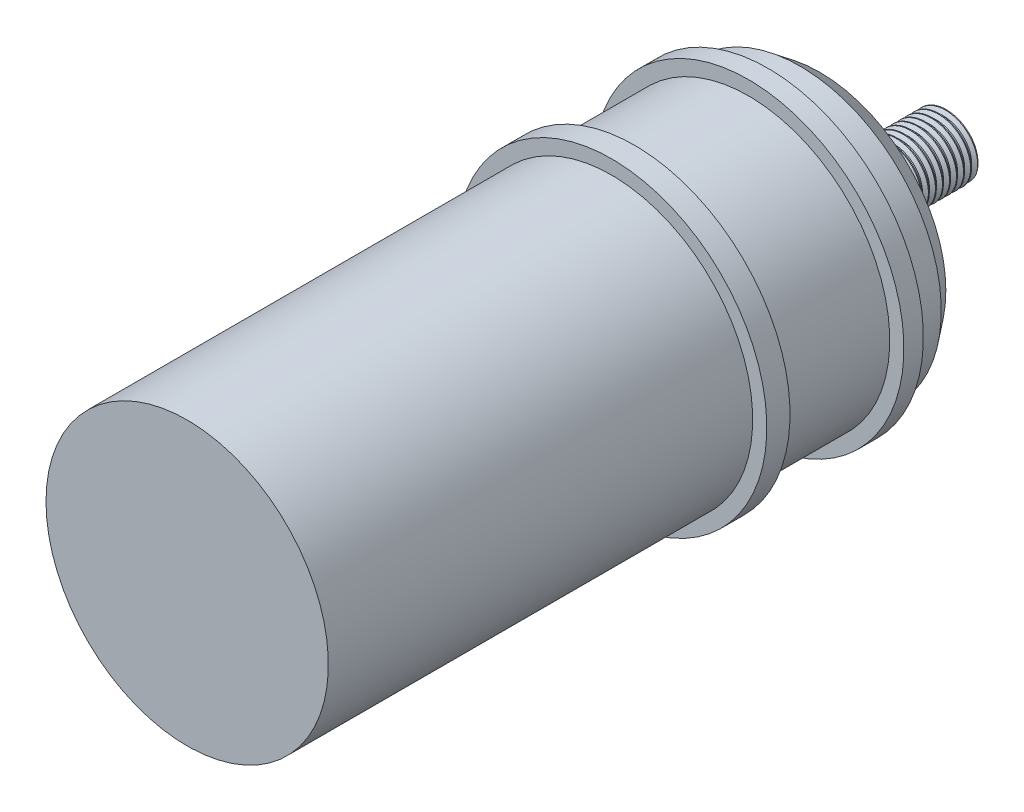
SolidWorks part; units mm, degrees
ref_plane "Front Plane" through (0, 0, 0) normal (0, 0, 1) x (1, 0, 0)
ref_plane "Top Plane" through (0, 0, 0) normal (0, 1, 0) x (1, 0, 0)
ref_plane "Right Plane" through (0, 0, 0) normal (1, 0, 0) x (0, 0, -1)
sketch "Sketch1" plane through (0, 0, 0) normal (1, 0, 0) x (0, 0, -1)
  line L0 (-95.3804, 0) -> (-95.3804, 21.2564)
  line L1 (-95.3804, 21.2564) -> (-31.4943, 21.2564)
  line L2 (-31.4943, 21.2564) -> (-31.4943, 23.3807)
  line L3 (-31.4943, 23.3807) -> (-28.0015, 23.3807)
  line L4 (-28.0015, 23.3807) -> (-28.0015, 21.2564)
  line L5 (-28.0015, 21.2564) -> (-10.8586, 21.2564)
  line L6 (-10.8586, 21.2564) -> (-10.8586, 23.3807)
  line L7 (-10.8586, 23.3807) -> (-7.9217, 23.3807)
  line L8 (-7.9217, 23.3807) -> (-7.9217, 21.2564)
  line L9 (-7.9217, 21.2564) -> (-3.1046, 21.2564)
  line L10 (-0.1304, 18.9726) -> (-0.1304, 4.7625)
  line L11 (-0.1304, 4.7625) -> (18.9196, 4.7625)
  line L12 (18.9196, 4.7625) -> (18.9196, 1.778)
  line L13 (-0.1304, 0) -> (-95.3804, 0)
  line L14 (18.9196, 1.778) -> (-0.1304, 1.778)
  line L15 (-0.1304, 1.778) -> (-0.1304, 0)
  line L16 (18.9196, 0) -> (-0.1304, 0) construction
  line L17 (18.9196, 1.778) -> (18.9196, 0) construction
  line L18 (-3.1046, 21.2564) -> (-0.1304, 18.9726)
  dimension "D1" = 114.3
  dimension "D2" = 4.7625
  dimension "D3" = 19.05
  dimension "D4" = 1.778
revolve "Revolve1" add sketch "Sketch1" angle 360 about L13
thread "Thread1" pitch 1.0583 start angle 0, offset 1, length 0, pitch 1.0583, diameter 9.525
ref_plane "Plane1" through (4.7625, 0, -19.9196) normal (0, -1, 0) x (1, 0, 0)
sketch "Thread Profile1" plane through (4.7625, 0, -19.9196) normal (0, -1, 0) x (1, 0, 0)
  line L0 (0, 0) -> (0, 1.0583) construction
  line L11 (0, 0) -> (0, 0.926)
  line L12 (0, 0.926) -> (-0.5728, 0.5953)
  line L13 (-0.5728, 0.5953) -> (-0.5728, 0.3307)
  line L15 (-0.5728, 0.3307) -> (0, 0)
  line L17 (-0.5728, 0.463) -> (0, 0.463) construction
  point P2 (0, 0)
  dimension "Pitch" = 1.0583
  dimension "Profile_Angle" = 60
  dimension "Profile_Land" = 0.2646
  dimension "Profile_Height" = 0.5728
